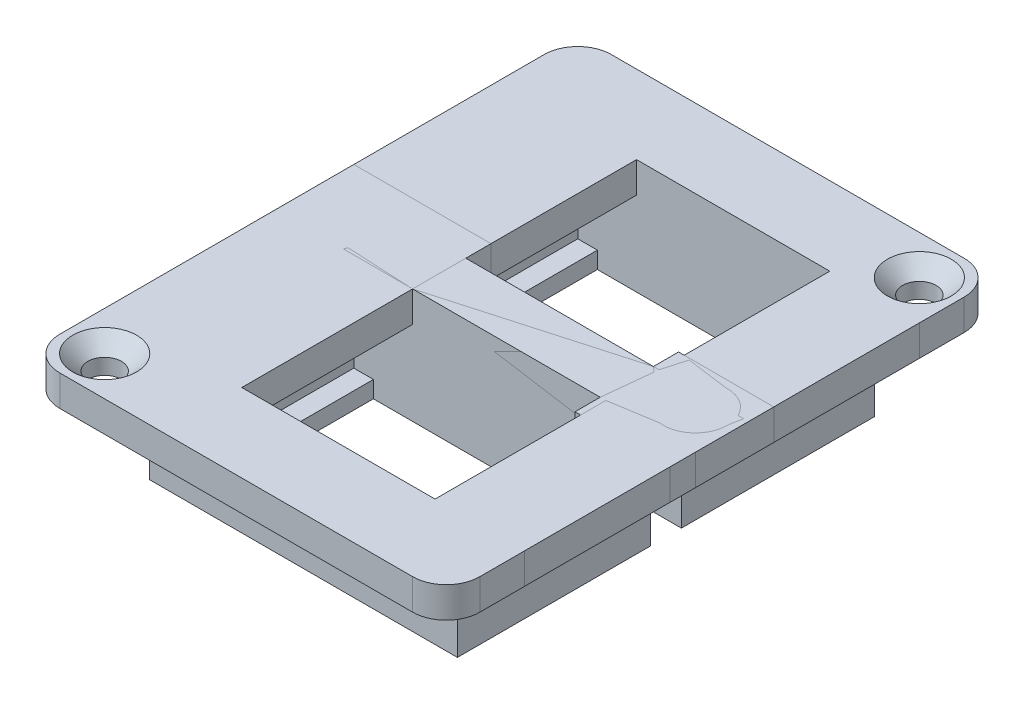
SolidWorks part; units mm, degrees
ref_plane "Front Plane" through (0, 0, 0) normal (0, 0, 1) x (1, 0, 0)
ref_plane "Top Plane" through (0, 0, 0) normal (0, 1, 0) x (1, 0, 0)
ref_plane "Right Plane" through (0, 0, 0) normal (1, 0, 0) x (0, 0, -1)
sketch "Sketch1" plane through (0, 0, 0) normal (0, 0, 1) x (1, 0, 0)
  line L0 (-5.75, 0) -> (10.25, 0) construction
  line L1 (10.25, 0) -> (10.25, -6.5) construction
  line L2 (10.25, -8) -> (11.75, -8) construction
  line L3 (-10.25, -10) -> (-10.25, -13.8781) construction
  line L4 (11.75, -8) -> (10.25, -6.5) construction
  line L5 (10.25, -8) -> (10.25, -9.5)
  line L6 (10.25, -10) -> (-5.75, -10) construction
  line L7 (-8.75, -8) -> (-8.75, -13.8781) construction
  line L8 (-5.75, 0) -> (-5.75, -10) construction
  line L9 (-5.75, 0) -> (-5.75, -8) construction
  line L10 (10.25, 0) -> (10.25, -8) construction
  line L11 (-10.25, -5) -> (-8.75, -8) construction
  line L12 (-10.25, -5) -> (-11.25, -8) construction
  line L13 (-11.75, -8) -> (-10, -8)
  line L14 (-8.75, -5) -> (-8.75, -10) construction
  line L15 (-10.25, -5) -> (-10.25, -10) construction
  line L16 (-8.75, -13.8781) -> (-10.25, -13.8781) construction
  line L19 (10.7534, 0.75) -> (10.7534, -1.9966)
  line L22 (10.25, -8) -> (11.75, -8)
  line L23 (11.75, -8) -> (11.75, -1.9966)
  line L27 (13.75, -1.9966) -> (18.75, -1.9966)
  line L33 (2.25, 0) -> (2.25, -10) construction
  line L47 (-11.75, -8) -> (-11.75, -1.9966)
  line L51 (-13.75, -1.9966) -> (-13.75, -9.5)
  line L53 (-13.75, -1.9966) -> (-18.75, -1.9966)
  line L59 (13.75, -1.9966) -> (13.75, -9.5)
  line L60 (18.75, 0.75) -> (18.75, -1.9966)
  line L61 (-18.75, 0.75) -> (-18.75, -1.9966)
  line L64 (-6.5034, -1.9966) -> (-11.75, -1.9966)
  line L65 (10.7534, -1.9966) -> (11.75, -1.9966)
  line L69 (-10, -9.5) -> (-10, -8)
  line L70 (-13.75, -9.5) -> (-10, -9.5)
  line L71 (-11.75, -9.5) -> (-10, -9.5) construction
  line L72 (10.25, -9.5) -> (13.75, -9.5)
  line L73 (10.25, -9.5) -> (11.75, -9.5) construction
  line L74 (-6.5034, 0.75) -> (-6.5034, -1.9966)
  line L75 (-6.5034, 0.75) -> (-18.75, 0.75)
  line L76 (10.7534, 0.75) -> (18.75, 0.75)
  dimension "D1" = 27.5
  dimension "D2" = 5
  dimension "D3" = 1.5
  dimension "D4" = 16
  dimension "D5" = 1.5
  dimension "D6" = 6.5
  dimension "D7" = 10
  dimension "D8" = 5
extrude "Boss-Extrude1" add sketch "Sketch1" along normal blind 15.25
sketch "Sketch2" plane through (0, 0, 15.25) normal (0, 0, 1) x (1, 0, 0)
  line L2 (18.7534, -1.9966) -> (-18.7534, -1.9966)
  line L4 (-18.7534, -1.9966) -> (-18.7534, 0.75)
  line L5 (18.7534, 0.75) -> (18.7534, -1.9966)
  line L7 (-18.7534, 0.75) -> (18.7534, 0.75)
extrude "Boss-Extrude2" add sketch "Sketch2" along normal blind 7
sketch "Sketch3" plane through (0, 0, 0) normal (0, 0, -1) x (-1, 0, 0)
  line L2 (18.7534, -1.9966) -> (-18.7534, -1.9966)
  line L4 (-18.7534, -1.9966) -> (-18.7534, 0.75)
  line L5 (18.7534, 0.75) -> (18.7534, -1.9966)
  line L7 (-18.7534, 0.75) -> (18.7534, 0.75)
extrude "Boss-Extrude3" add sketch "Sketch3" along normal blind 7
sketch "Sketch9" plane through (0, -1.9966, 0) normal (0, -1, 0) x (1, 0, 0)
  line L0 (18.75, 15.25) -> (18.75, 0) construction
  line L1 (18.7534, -7) -> (-18.7534, -7) construction
  line L2 (-18.75, 15.25) -> (-18.75, 0) construction
  line L3 (-18.7534, 22.25) -> (18.7534, 22.25) construction
  circle A1 centre (-15.25, 18.75) radius 1.5
  circle A5 centre (15.25, -3.5) radius 1.5
  dimension "D1" = 3.5
  dimension "D3" = 3.5
  dimension "D2" = 3.5
  dimension "D4" = 3.5
extrude "Cut-Extrude1" cut sketch "Sketch9" against normal blind 12
sketch "Sketch10" plane through (0, 0.75, 0) normal (0, 1, 0) x (1, 0, 0)
  circle A0 centre (-15.25, -18.75) radius 2.85
  circle A1 centre (15.25, 3.5) radius 2.85
extrude "Cut-Extrude2" cut sketch "Sketch10" against normal blind 6 draft 45
sketch "Sketch11" plane through (0, -1.9966, 0) normal (0, -1, 0) x (1, 0, 0)
  line L0 (-13.75, 15.25) -> (13.75, 15.25)
  line L21 (-13.75, 16.25) -> (13.75, 16.25)
  line L22 (-11.75, 16.25) -> (-6.2534, 16.25) construction
  line L25 (-11.75, 15.25) -> (-6.2534, 15.25) construction
  line L26 (-13.75, 15.25) -> (-13.75, 16.25)
  line L27 (13.75, 15.25) -> (13.75, 16.25)
  line L28 (13.75, 0) -> (13.75, -1)
  line L29 (-13.75, 0) -> (-13.75, -1)
  line L30 (-13.75, -1) -> (13.75, -1)
  line L31 (-13.75, 0) -> (13.75, 0)
extrude "Boss-Extrude5" add sketch "Sketch11" along normal up to vertex (7.5034 mm away) contours L21 L27 L0 L26 | L28 L30 L29 L31
ref_plane "Plane2" through (0, 0, -4) normal (0, 0, -1) x (-1, 0, 0)
pattern_linear "LPattern3" count 2 spacing 20 along (0, 0, -1) of "Boss-Extrude1"
fillet "Fillet1" radius 3 2 edges at (18.7534, -0.6233, 22.25) (-18.7534, -0.6233, 22.25)
fillet "Fillet2" radius 3 2 edges at (18.7534, -0.6233, -27) (-18.7534, -0.6233, -27)
sketch "Sketch13" plane through (0, -1.9966, 0) normal (0, -1, 0) x (1, 0, 0)
  line L0 (-6.5034, 7.625) -> (10.25, 7.625) construction
  line L1 (-6.5034, 15.25) -> (-6.5034, 0) construction
  line L2 (10.25, 15.25) -> (10.25, 0) construction
  line L3 (-6.5034, 15.25) -> (10.25, 15.25)
  line L4 (10.25, 15.25) -> (10.25, 0)
  line L5 (10.25, 0) -> (-6.5034, 0)
  line L6 (-6.5034, 15.25) -> (-6.5034, 0)
  line L7 (-6.5034, -20) -> (10.25, -20)
  line L8 (10.25, -20) -> (10.25, -4.75)
  line L9 (10.25, -4.75) -> (-6.5034, -4.75)
  line L10 (-6.5034, -4.75) -> (-6.5034, -20)
extrude "Cut-Extrude4" cut sketch "Sketch13" against normal blind 10
